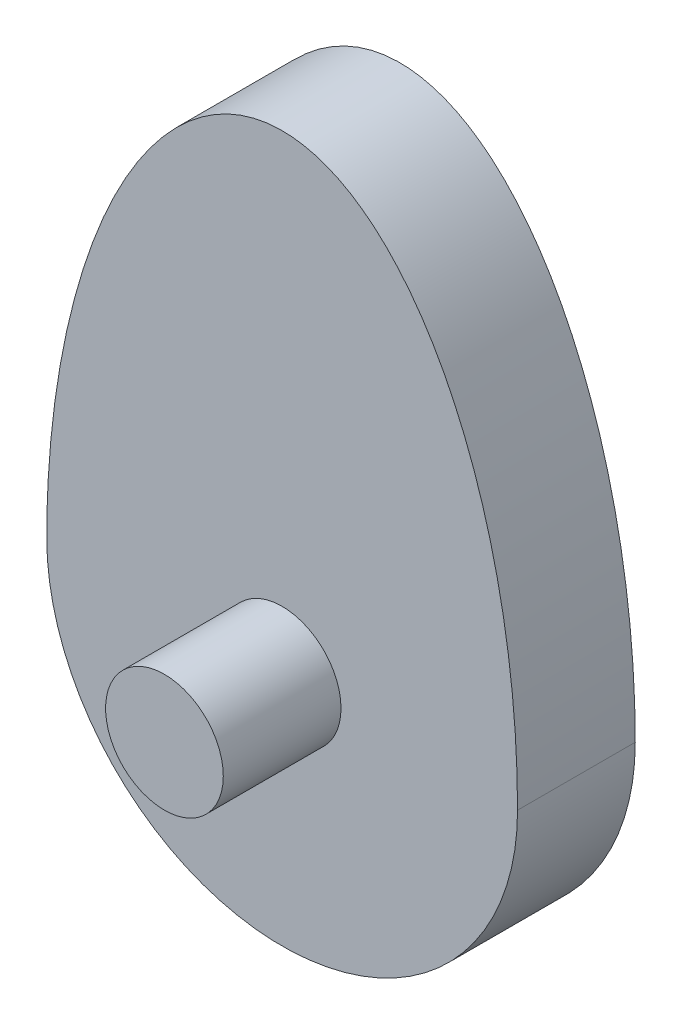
SolidWorks part; units mm, degrees
ref_plane "Płaszczyzna przednia" through (0, 0, 0) normal (0, 0, 1) x (1, 0, 0)
ref_plane "Płaszczyzna górna" through (0, 0, 0) normal (0, 1, 0) x (1, 0, 0)
ref_plane "Płaszczyzna prawa" through (0, 0, 0) normal (1, 0, 0) x (0, 0, -1)
sketch "Szkic1" plane through (0, 0, 0) normal (0, 0, 1) x (1, 0, 0)
  line L0 (-40, 0) -> (40, 0) construction
  arc A0 (-40, 0) -> (40, 0) centre (0, 0) ccw
  ellipse E0 centre (0, 0) end of major axis (0, 80) minor radius 40 (40, 0) -> (-40, 0) ccw
  dimension "D1" = 40
  dimension "D2" = 80
extrude "Dodanie-wyciągnięcie1" add sketch "Szkic1" along normal blind 20
sketch "Szkic2" plane through (0, 0, 20) normal (0, 0, 1) x (1, 0, 0)
  circle A0 centre (0, 0) radius 10
  dimension "D1" = 20
extrude "Dodanie-wyciągnięcie2" add sketch "Szkic2" along normal blind 20
sketch "Szkic3" plane through (0, 0, 0) normal (0, 0, -1) x (-1, 0, 0)
  circle A0 centre (0, 0) radius 15
  circle A1 centre (0, 0) radius 5
  dimension "D1" = 30
  dimension "10" = 10
extrude "Dodanie-wyciągnięcie3" add sketch "Szkic3" along normal blind 10
